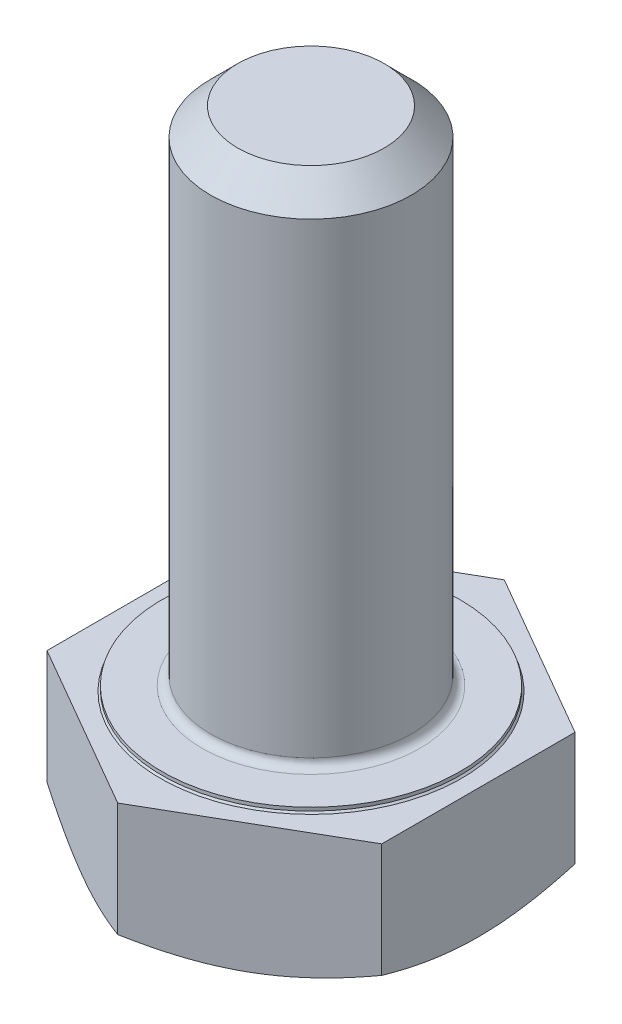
SolidWorks part; units mm, degrees
ref_plane "Plan de face" through (0, 0, 0) normal (0, 0, 1) x (1, 0, 0)
ref_plane "Plan de dessus" through (0, 0, 0) normal (0, 1, 0) x (1, 0, 0)
ref_plane "Plan de droite" through (0, 0, 0) normal (1, 0, 0) x (0, 0, -1)
imported_body "Importée3"
sketch "Esquisse1" plane through (0, -3.5534, 0) normal (0, 1, 0) x (-1, 0, 0)
  line L0 (5, 2.8868) -> (5, -2.8868)
  line L1 (5, -2.8868) -> (0, -5.7735)
  line L2 (0, -5.7735) -> (-5, -2.8868)
  line L3 (-5, -2.8868) -> (-5, 2.8868)
  line L4 (-5, 2.8868) -> (0, 5.7735)
  line L5 (0, 5.7735) -> (5, 2.8868)
extrude "Boss.-Extru.1" add sketch "Esquisse1" along normal blind 3.4034
sketch "Esquisse2" plane through (0, 0, 0) normal (0, 0, 1) x (1, 0, 0)
  line L0 (3, 15) -> (0, 15)
  line L1 (0, 15) -> (0, -0.15)
  line L2 (0, -0.15) -> (4.45, -0.15)
  line L3 (4.45, -0.15) -> (4.45, 0)
  line L4 (4.45, 0) -> (3, 0)
  line L5 (3, 0) -> (3, 15)
  line L6 (0, 15) -> (0, -0.15) construction
revolve "Révolution1" add sketch "Esquisse2" angle 360 about L6
chamfer "Chanfrein1" distance 0.8119 angle 45 1 edges at (0, 15, -3)
chamfer "Chanfrein2" distance 0.05 angle 45 1 edges at (0, -0.15, -4.45)
fillet "Congé1" radius 0.25 1 edges at (0, 0, -3)
